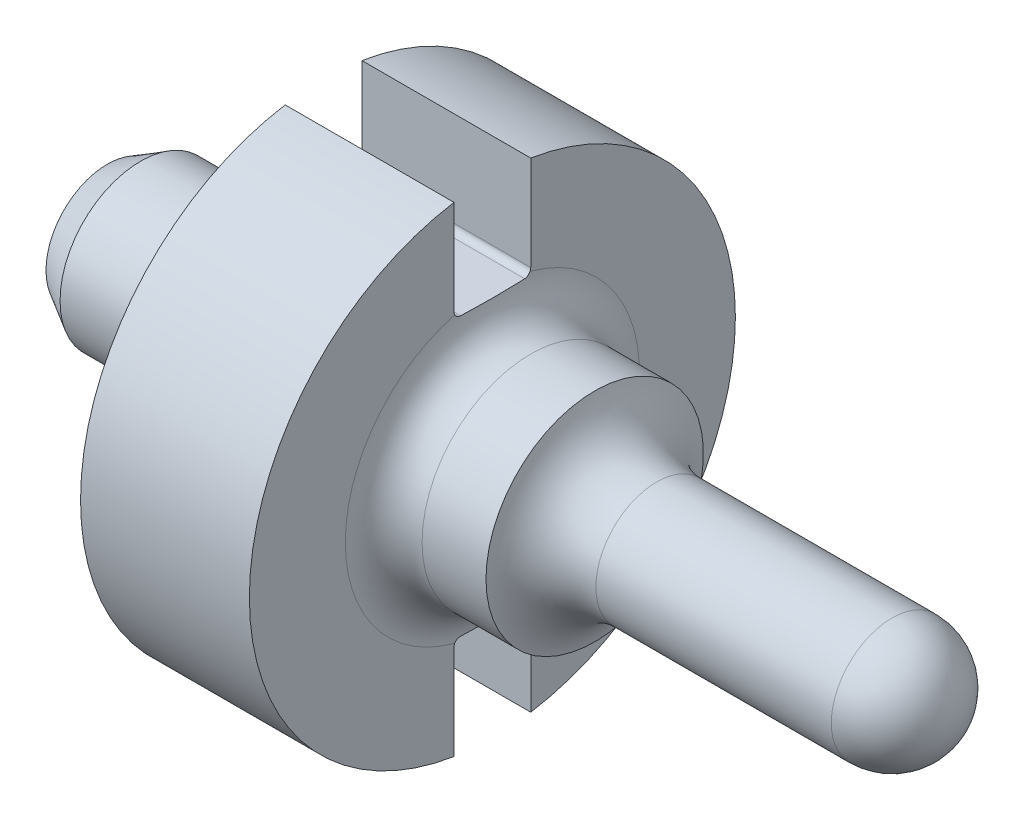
SolidWorks part; units mm, degrees
ref_plane "Front Plane" through (0, 0, 0) normal (0, 0, 1) x (1, 0, 0)
ref_plane "Top Plane" through (0, 0, 0) normal (0, 1, 0) x (1, 0, 0)
ref_plane "Right Plane" through (0, 0, 0) normal (1, 0, 0) x (0, 0, -1)
sketch "Sketch1" plane through (0, 0, 0) normal (0, 0, 1) x (1, 0, 0)
  line L0 (0, 8.0205) -> (0, 0) construction
  line L1 (0, 0) -> (2.413, 0) construction
  line L2 (0, 0) -> (0, 1.2192)
  line L3 (0.6599, 1.6002) -> (3.5306, 1.6002)
  line L4 (4.2926, 2.3622) -> (4.2926, 4.826)
  line L5 (4.2926, 4.826) -> (7.6454, 4.826)
  line L6 (7.6454, 4.826) -> (7.6454, 2.921)
  line L7 (8.4074, 2.159) -> (9.6774, 2.159)
  line L9 (10.9071, 1.2065) -> (15.5829, 1.2065)
  line L10 (0, 0) -> (16.7894, 0)
  line L11 (16.7894, 0) -> (16.7894, 7.413) construction
  line L12 (0, 1.2192) -> (0.6599, 1.6002)
  arc A0 (15.5829, 1.2065) -> (16.7894, 0) centre (15.5829, 0) cw
  arc A1 (7.6454, 2.921) -> (8.4074, 2.159) centre (8.4074, 2.921) ccw
  arc A2 (3.5306, 1.6002) -> (4.2926, 2.3622) centre (3.5306, 2.3622) ccw
  arc A3 (9.6774, 2.159) -> (10.9071, 1.2065) centre (10.9071, 2.4765) ccw
  point P5 (0, 1.6002)
  dimension "D11" = 0.762
  dimension "D12" = 1.27
  dimension "D1" = 9.652
  dimension "D2" = 4.318
  dimension "D3" = 2.413
  dimension "D4" = 3.2004
  dimension "D5" = 16.7894
  dimension "D6" = 12.4968
  dimension "D7" = 9.144
  dimension "D8" = 7.112
  dimension "D9" = 0.381
  dimension "D10" = 60
revolve "Revolve1" add sketch "Sketch1" angle 360 about L10
sketch "Sketch2" plane through (4.2926, 0, 0) normal (-1, 0, 0) x (0, 0, 1)
  line L0 (-4.826, 0) -> (0, 0) construction
  line L1 (0, 0) -> (0, 4.826) construction
  line L2 (-0.762, -6.8961) -> (0.762, -2.7559) construction
  line L3 (-0.635, 2.7559) -> (0.635, 2.7559)
  line L4 (-0.762, 2.8829) -> (-0.762, 6.8961)
  line L5 (-0.762, 6.8961) -> (0.762, 6.8961)
  line L6 (0.762, 2.8829) -> (0.762, 6.8961)
  line L7 (-0.762, 2.7559) -> (0.762, 6.8961) construction
  line L8 (-0.762, 6.8961) -> (0.762, 2.7559) construction
  line L9 (-0.762, -2.7559) -> (0.762, -6.8961) construction
  line L10 (0.762, -2.8829) -> (0.762, -6.8961)
  line L11 (-0.762, -6.8961) -> (0.762, -6.8961)
  line L12 (-0.762, -2.8829) -> (-0.762, -6.8961)
  line L13 (-0.635, -2.7559) -> (0.635, -2.7559)
  circle A0 centre (0, 0) radius 4.826 construction
  arc A1 (0.635, -2.7559) -> (0.762, -2.8829) centre (0.635, -2.8829) cw
  arc A2 (-0.635, -2.7559) -> (-0.762, -2.8829) centre (-0.635, -2.8829) ccw
  arc A3 (0.635, 2.7559) -> (0.762, 2.8829) centre (0.635, 2.8829) ccw
  arc A4 (-0.635, 2.7559) -> (-0.762, 2.8829) centre (-0.635, 2.8829) cw
  dimension "D3" = 0.127
  dimension "D1" = 5.5118
  dimension "D2" = 1.524
extrude "Cut-Extrude1" cut sketch "Sketch2" against normal up to next
